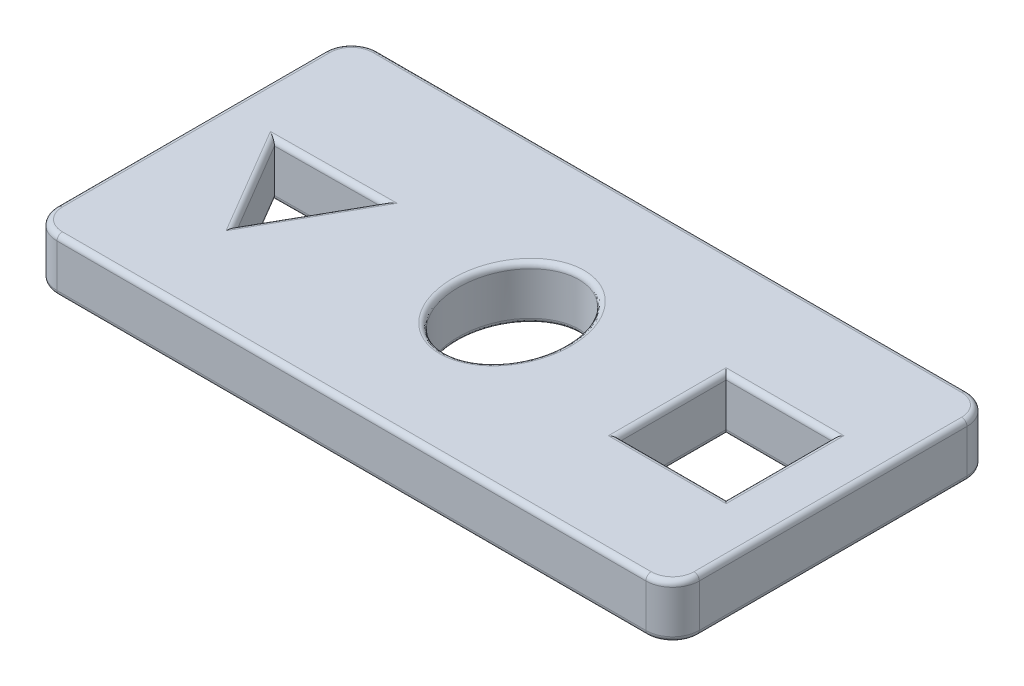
SolidWorks part; units mm, degrees
ref_plane "Front" through (0, 0, 0) normal (0, 0, 1) x (1, 0, 0)
ref_plane "Top" through (0, 0, 0) normal (0, 1, 0) x (1, 0, 0)
ref_plane "Right" through (0, 0, 0) normal (1, 0, 0) x (0, 0, -1)
sketch "Esquisse1" plane through (0, 0, 0) normal (0, 1, 0) x (1, 0, 0)
  line L1 (-60, 30) -> (60, 30)
  line L2 (-60, 30) -> (-60, -30)
  line L3 (-60, -30) -> (60, -30)
  line L4 (60, 30) -> (60, -30)
  line L5 (-60, 30) -> (60, -30) construction
  line L6 (-60, -30) -> (60, 30) construction
  point P0 (0, 0)
  dimension "D1" = 60
  dimension "D2" = 120
extrude "Boss.-Extru.1" add sketch "Esquisse1" along normal blind 10
sketch "Esquisse2" plane through (0, 10, 0) normal (0, 1, 0) x (1, 0, 0)
  line L1 (-30.0534, 5.866) -> (-50.0534, 5.681)
  line L2 (-50.0534, 5.681) -> (-39.8932, -11.547)
  line L3 (-39.8932, -11.547) -> (-30.0534, 5.866)
  line L4 (30, 10) -> (50, 10)
  line L5 (30, 10) -> (30, -10)
  line L6 (30, -10) -> (50, -10)
  line L7 (50, 10) -> (50, -10)
  line L8 (30, 10) -> (50, -10) construction
  line L9 (30, -10) -> (50, 10) construction
  circle A0 centre (-40, 0) radius 5.7737 construction
  ellipse E0 centre (0, 0) end of major axis (0, -12.5) minor radius 10
  point P1 (40, 0)
  dimension "D1" = 20
  dimension "D2" = 20
  dimension "D3" = 25
  dimension "D4" = 20
  dimension "D5" = 40
  dimension "D6" = 40
extrude "Enlèv. mat.-Extru.1" cut sketch "Esquisse2" against normal through all
fillet "Congé1" radius 5 4 edges at (-60, 5, 30) (60, 5, 30) (60, 5, -30) (-60, 5, -30)
fillet "Congé2" radius 1 32 edges at (58.5355, 0, 28.5355) (60, 0, 0) (58.5355, 0, -28.5355) (0, 0, -30) (-58.5355, 0, -28.5355) (-60, 0, 0) (-58.5355, 0, 28.5355) (0, 0, 30) (0, 0, 12.5) (30, 0, 0) (40, 0, -10) (50, 0, 0) (40, 0, 10) (-40.0534, 0, -5.7735) (-34.9733, 0, 2.8405) (-44.9733, 0, 2.933) (-58.5355, 10, -28.5355) (0, 10, -30) (58.5355, 10, -28.5355) (60, 10, 0) (58.5355, 10, 28.5355) (0, 10, 30) (-58.5355, 10, 28.5355) (-60, 10, 0) (0, 10, 12.5) (40, 10, -10) (30, 10, 0) (40, 10, 10) (50, 10, 0) (-40.0534, 10, -5.7735) (-44.9733, 10, 2.933) (-34.9733, 10, 2.8405)
